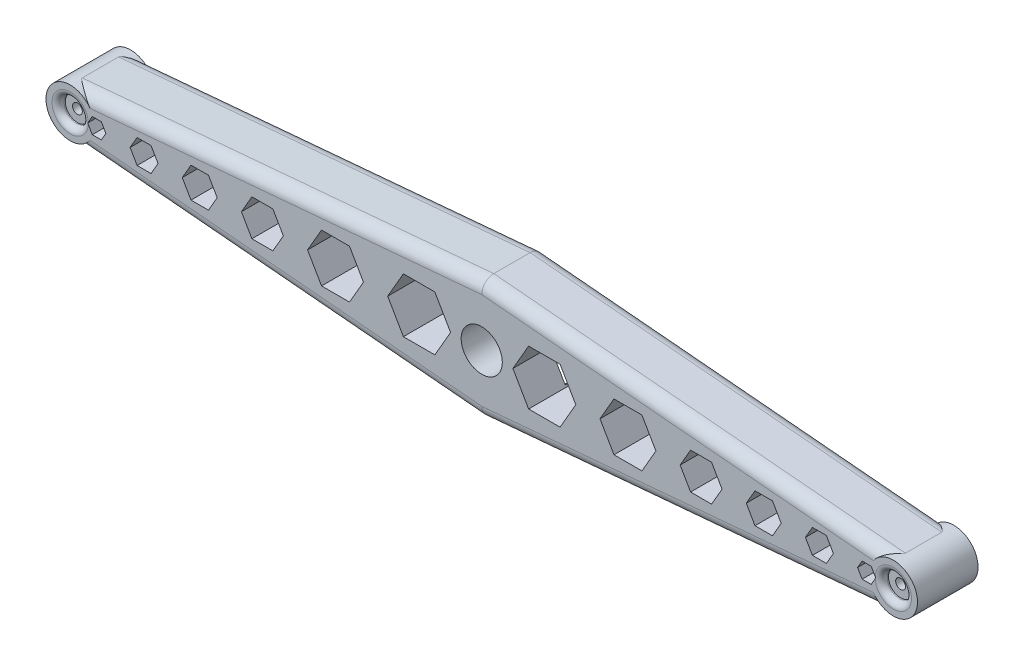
SolidWorks part; units mm, degrees
ref_plane "Front Plane" through (0, 0, 0) normal (0, 0, 1) x (1, 0, 0)
ref_plane "Top Plane" through (0, 0, 0) normal (0, 1, 0) x (1, 0, 0)
ref_plane "Right Plane" through (0, 0, 0) normal (1, 0, 0) x (0, 0, -1)
sketch "Sketch1" plane through (0, 0, 0) normal (0, 0, 1) x (1, 0, 0)
  line L0 (-86.36, 0) -> (86.36, 0) construction
  line L1 (0, 12.7) -> (0, -12.7) construction
  line L2 (0, 12.7) -> (-86.36, 5.08)
  line L3 (-86.36, -5.08) -> (0, -12.7)
  line L4 (0, -12.7) -> (86.36, -5.08)
  line L5 (0, 12.7) -> (86.36, 5.08)
  line L37 (-9.8367, 5.715) -> (-16.4358, 5.715)
  line L38 (-16.4358, 5.715) -> (-19.7353, 0)
  line L39 (-19.7353, 0) -> (-16.4358, -5.715)
  line L40 (-16.4358, -5.715) -> (-9.8367, -5.715)
  line L41 (-9.8367, -5.715) -> (-6.5371, 0)
  line L42 (-6.5371, 0) -> (-9.8367, 5.715)
  line L43 (-27.7483, 5.08) -> (-33.6141, 5.08)
  line L44 (-33.6141, 5.08) -> (-36.5471, 0)
  line L45 (-36.5471, 0) -> (-33.6141, -5.08)
  line L46 (-33.6141, -5.08) -> (-27.7483, -5.08)
  line L47 (-27.7483, -5.08) -> (-24.8153, 0)
  line L48 (-24.8153, 0) -> (-27.7483, 5.08)
  line L49 (-43.8268, 3.81) -> (-48.2262, 3.81)
  line L50 (-48.2262, 3.81) -> (-50.4259, 0)
  line L51 (-50.4259, 0) -> (-48.2262, -3.81)
  line L52 (-48.2262, -3.81) -> (-43.8268, -3.81)
  line L53 (-43.8268, -3.81) -> (-41.6271, 0)
  line L54 (-41.6271, 0) -> (-43.8268, 3.81)
  line L73 (-57.339, 3.175) -> (-61.0052, 3.175)
  line L74 (-61.0052, 3.175) -> (-62.8382, 0)
  line L75 (-62.8382, 0) -> (-61.0052, -3.175)
  line L76 (-61.0052, -3.175) -> (-57.339, -3.175)
  line L77 (-57.339, -3.175) -> (-55.5059, 0)
  line L78 (-55.5059, 0) -> (-57.339, 3.175)
  line L80 (-69.3847, 2.54) -> (-72.3177, 2.54)
  line L81 (-72.3177, 2.54) -> (-73.7841, 0)
  line L82 (-73.7841, 0) -> (-72.3177, -2.54)
  line L83 (-72.3177, -2.54) -> (-69.3847, -2.54)
  line L84 (-69.3847, -2.54) -> (-67.9182, 0)
  line L85 (-67.9182, 0) -> (-69.3847, 2.54)
  line L86 (-79.8173, 1.651) -> (-81.7237, 1.651)
  line L87 (-81.7237, 1.651) -> (-82.6769, 0)
  line L88 (-82.6769, 0) -> (-81.7237, -1.651)
  line L89 (-81.7237, -1.651) -> (-79.8173, -1.651)
  line L90 (-79.8173, -1.651) -> (-78.8641, 0)
  line L91 (-78.8641, 0) -> (-79.8173, 1.651)
  line L92 (6.5371, 0) -> (9.8367, 5.715)
  line L93 (9.8367, -5.715) -> (6.5371, 0)
  line L94 (16.4358, -5.715) -> (9.8367, -5.715)
  line L95 (19.7353, 0) -> (16.4358, -5.715)
  line L96 (16.4358, 5.715) -> (19.7353, 0)
  line L97 (9.8367, 5.715) -> (16.4358, 5.715)
  line L98 (24.8153, 0) -> (27.7483, 5.08)
  line L99 (27.7483, -5.08) -> (24.8153, 0)
  line L100 (33.6141, -5.08) -> (27.7483, -5.08)
  line L101 (36.5471, 0) -> (33.6141, -5.08)
  line L102 (33.6141, 5.08) -> (36.5471, 0)
  line L103 (27.7483, 5.08) -> (33.6141, 5.08)
  line L104 (41.6271, 0) -> (43.8268, 3.81)
  line L105 (43.8268, -3.81) -> (41.6271, 0)
  line L106 (48.2262, -3.81) -> (43.8268, -3.81)
  line L107 (50.4259, 0) -> (48.2262, -3.81)
  line L108 (48.2262, 3.81) -> (50.4259, 0)
  line L109 (43.8268, 3.81) -> (48.2262, 3.81)
  line L110 (55.5059, 0) -> (57.339, 3.175)
  line L111 (57.339, -3.175) -> (55.5059, 0)
  line L112 (61.0052, -3.175) -> (57.339, -3.175)
  line L113 (62.8382, 0) -> (61.0052, -3.175)
  line L114 (61.0052, 3.175) -> (62.8382, 0)
  line L115 (57.339, 3.175) -> (61.0052, 3.175)
  line L116 (67.9182, 0) -> (69.3847, 2.54)
  line L117 (69.3847, -2.54) -> (67.9182, 0)
  line L118 (72.3177, -2.54) -> (69.3847, -2.54)
  line L119 (73.7841, 0) -> (72.3177, -2.54)
  line L120 (72.3177, 2.54) -> (73.7841, 0)
  line L121 (69.3847, 2.54) -> (72.3177, 2.54)
  line L122 (78.8641, 0) -> (79.8173, 1.651)
  line L123 (79.8173, -1.651) -> (78.8641, 0)
  line L124 (81.7237, -1.651) -> (79.8173, -1.651)
  line L125 (82.6769, 0) -> (81.7237, -1.651)
  line L126 (81.7237, 1.651) -> (82.6769, 0)
  line L127 (79.8173, 1.651) -> (81.7237, 1.651)
  arc A0 (-86.36, 5.08) -> (-86.36, -5.08) centre (-86.36, 0) ccw
  arc A1 (86.36, -5.08) -> (86.36, 5.08) centre (86.36, 0) ccw
  circle A2 centre (-59.1721, 0) radius 3.175 construction
  circle A3 centre (-46.0265, 0) radius 3.81 construction
  circle A4 centre (-70.8512, 0) radius 2.54 construction
  circle A5 centre (-80.7705, 0) radius 1.651 construction
  circle A7 centre (-13.1362, 0) radius 5.715 construction
  circle A8 centre (-30.6812, 0) radius 5.08 construction
  point P68 (-46.0265, -3.81)
  dimension "D3" = 10.16
  dimension "D4" = 10.16
  dimension "D1" = 172.72
  dimension "D2" = 25.4
  dimension "D5" = 11.43
  dimension "D6" = 5.08
  dimension "D7" = 5.08
  dimension "D8" = 5.08
  dimension "D9" = 5.08
  dimension "D10" = 5.08
  dimension "D11" = 10.16
  dimension "D12" = 7.62
  dimension "D13" = 6.35
  dimension "D14" = 5.08
  dimension "D15" = 3.302
extrude "Boss-Extrude1" add sketch "Sketch1" along normal blind 12.7
fillet "Fillet1" radius 2.54 8 edges at (-43.18, -8.89, 0) (43.18, -8.89, 0) (43.18, 8.89, 0) (-43.18, 8.89, 0) (43.18, 8.89, 12.7) (43.18, -8.89, 12.7) (-43.18, -8.89, 12.7) (-43.18, 8.89, 12.7)
sketch "Sketch2" plane through (0, 0, 0) normal (0, 0, 1) x (1, 0, 0)
  circle A0 centre (0, 0) radius 11.049
  circle A1 centre (86.36, 0) radius 3.81
  circle A2 centre (-86.36, 0) radius 3.81
  dimension "D1" = 7.62
  dimension "D2" = 7.62
  dimension "D3" = 22.098
extrude "Cut-Extrude1" cut sketch "Sketch2" along normal blind 4.826
sketch "Sketch4" plane through (0, 0, 12.7) normal (0, 0, 1) x (1, 0, 0)
  circle A0 centre (86.36, 0) radius 2.54
  circle A1 centre (-86.36, 0) radius 2.54
  dimension "D1" = 5.08
  dimension "D2" = 5.08
extrude "Cut-Extrude2" cut sketch "Sketch4" against normal blind 1.524 contours A1 | A0
fillet "Fillet2" radius 1.27 2 edges at (88.9, 0, 12.7) (-83.82, 0, 12.7)
sketch "Sketch5" plane through (0, 0, 12.7) normal (0, 0, 1) x (1, 0, 0)
  circle A0 centre (86.36, 0) radius 1.0287
  circle A1 centre (-86.36, 0) radius 1.0287
  dimension "D1" = 2.0574
  dimension "D2" = 2.0574
extrude "Cut-Extrude3" cut sketch "Sketch5" against normal through all
sketch "Sketch6" plane through (0, 0, 12.7) normal (0, 0, 1) x (1, 0, 0)
  circle A0 centre (0, 0) radius 4.318
  dimension "D1" = 8.636
extrude "Cut-Extrude4" cut sketch "Sketch6" against normal up to surface (12.7 mm away)
